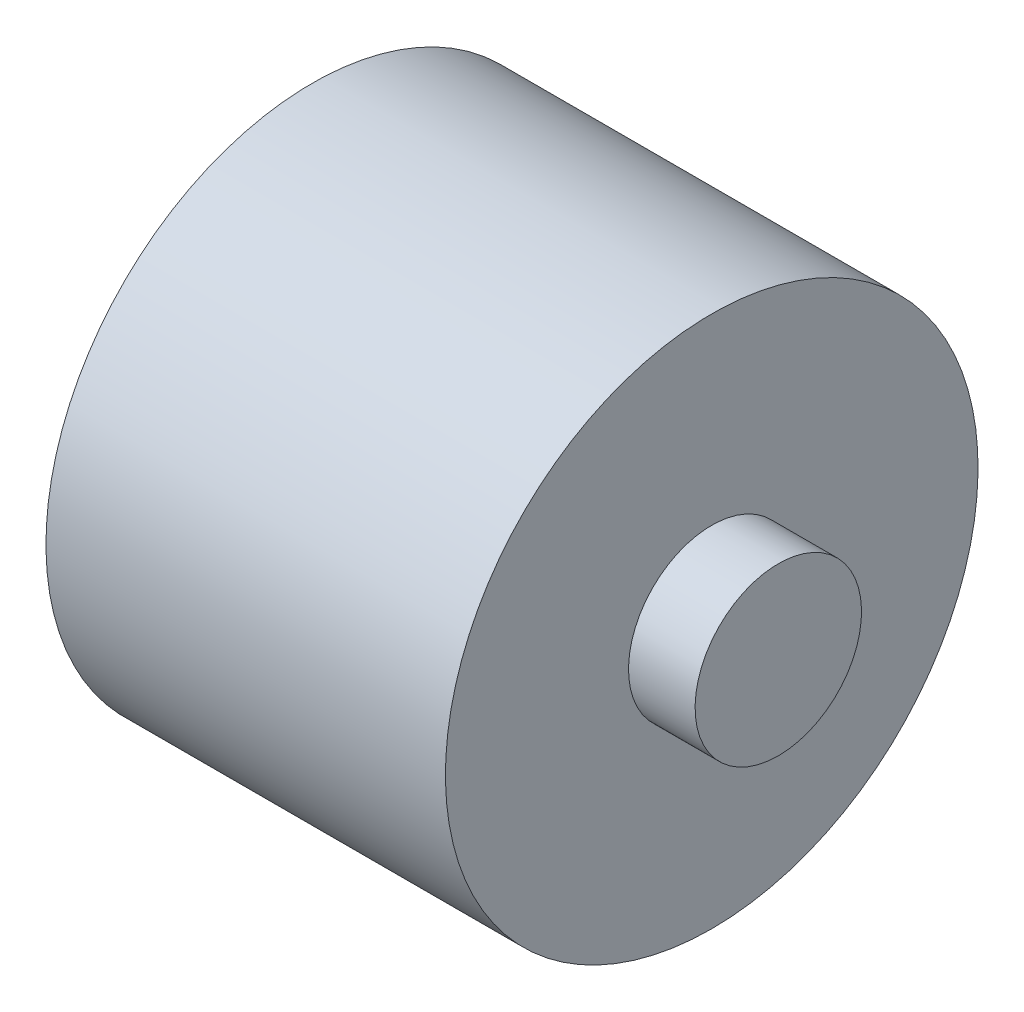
SolidWorks part; units mm, degrees
ref_plane "Front Plane" through (0, 0, 0) normal (0, 0, 1) x (1, 0, 0)
ref_plane "Top Plane" through (0, 0, 0) normal (0, 1, 0) x (1, 0, 0)
ref_plane "Right Plane" through (0, 0, 0) normal (1, 0, 0) x (0, 0, -1)
sketch "Sketch1" plane through (0, 0, 0) normal (0, 0, 1) x (1, 0, 0)
  line L0 (-4, 0) -> (4, 0) construction
  line L1 (-4, 0) -> (-4, 1.25)
  line L2 (-4, 1.25) -> (-3, 1.25)
  line L3 (-3, 1.25) -> (-3, 4)
  line L4 (-3, 4) -> (3, 4)
  line L5 (0, 4) -> (0, 0) construction
  line L6 (3, 1.25) -> (3, 4)
  line L7 (4, 1.25) -> (3, 1.25)
  line L8 (4, 0) -> (4, 1.25)
  line L9 (-4, 0) -> (4, 0)
  dimension "D1" = 2.5
  dimension "D2" = 6
  dimension "D3" = 8
  dimension "D4" = 8
revolve "Revolve1" add sketch "Sketch1" angle 360 about L9
